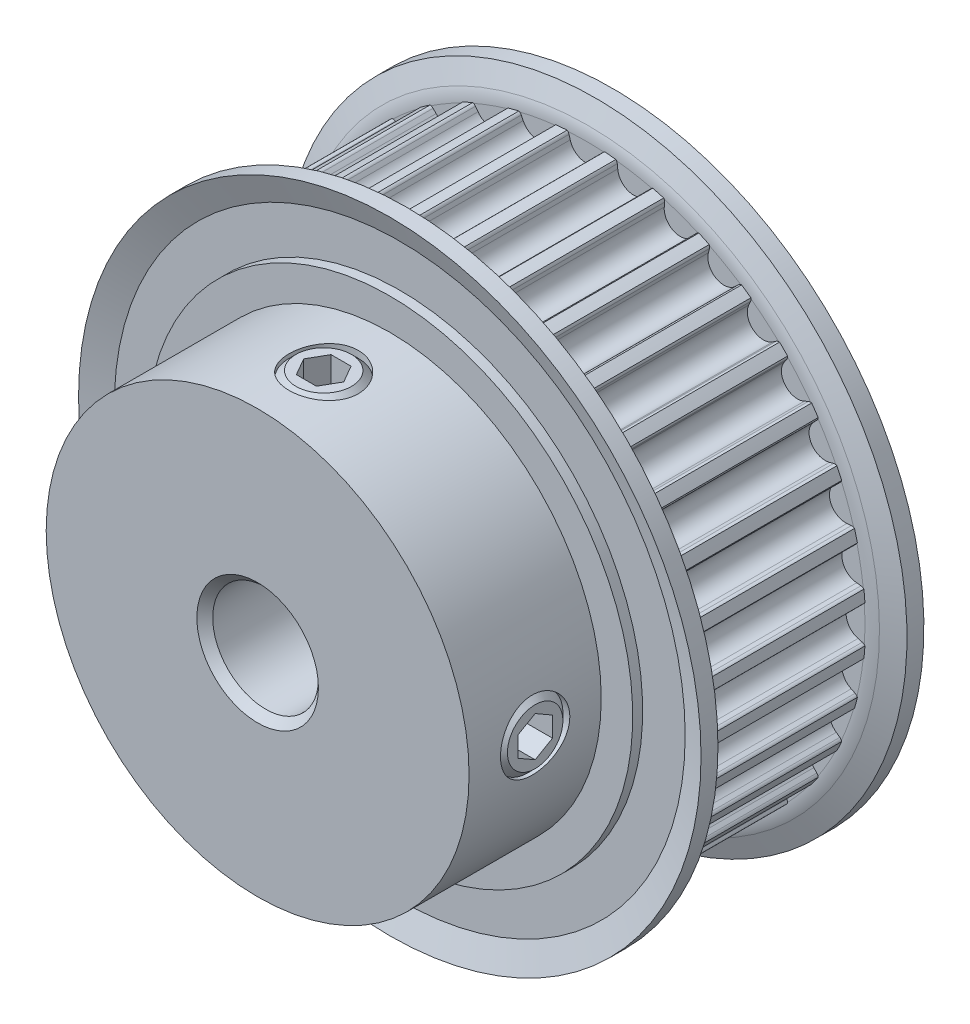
SolidWorks part; units mm, degrees
ref_plane "Front Plane" through (0, 0, 0) normal (0, 0, 1) x (1, 0, 0)
ref_plane "Top Plane" through (0, 0, 0) normal (0, 1, 0) x (1, 0, 0)
ref_plane "Right Plane" through (0, 0, 0) normal (1, 0, 0) x (0, 0, -1)
imported_body "Imported3"
sketch "Sketch1" plane through (0, 12.7, 0) normal (0, 1, 0) x (-1, 0, 0)
  line L0 (-1.2025, 3.9687) -> (-0.6013, 2.9273)
  line L1 (-0.6013, 2.9273) -> (0.6013, 2.9273)
  line L2 (0.6013, 2.9273) -> (1.2025, 3.9688)
  line L3 (1.2025, 3.9688) -> (0.6013, 5.0102)
  line L4 (0.6013, 5.0102) -> (-0.6013, 5.0102)
  line L5 (-0.6013, 5.0102) -> (-1.2025, 3.9687)
extrude "Cut-Extrude1" cut sketch "Sketch1" against normal blind 2.0828
sketch "Sketch2" plane through (12.7, 0, 0) normal (1, 0, 0) x (0, 0, -1)
  line L0 (-3.9687, -1.2025) -> (-2.9273, -0.6013)
  line L1 (-2.9273, -0.6013) -> (-2.9273, 0.6013)
  line L2 (-2.9273, 0.6013) -> (-3.9687, 1.2025)
  line L3 (-3.9687, 1.2025) -> (-5.0102, 0.6013)
  line L4 (-5.0102, 0.6013) -> (-5.0101, -0.6013)
  line L5 (-5.0101, -0.6013) -> (-3.9687, -1.2025)
extrude "Cut-Extrude2" cut sketch "Sketch2" against normal blind 2.0828
chamfer "Chamfer1" distance 0.4762 angle 45 2 edges at (-3.175, 0, 7.9375) (-3.175, 0, -13.3858)
sketch "Sketch3" plane through (0, 0, -13.3858) normal (0, 0, -1) x (-1, 0, 0)
  circle A0 centre (0, 0) radius 11.1125
  dimension "D1" = 22.225
hole_wizard "Hole1" positions "3DSketch1" profile "Sketch5" legacy
sketch3d "3DSketch1"
  point P0 (0, 0, -13.3858)
sketch "Sketch5" plane through (0, 0, -13.3858) normal (1, 0, 0) x (0, 1, 0)
  line L0 (0, 0) -> (0, 6.35)
  line L1 (0, 6.35) -> (11.1252, 6.35)
  line L2 (11.1252, 6.35) -> (11.1252, 0)
  line L3 (11.1252, 0) -> (0, 0)
  line L4 (0, 110) -> (0, -10) construction
  dimension "Diameter" = 22.2504
  dimension "Depth" = 6.35
